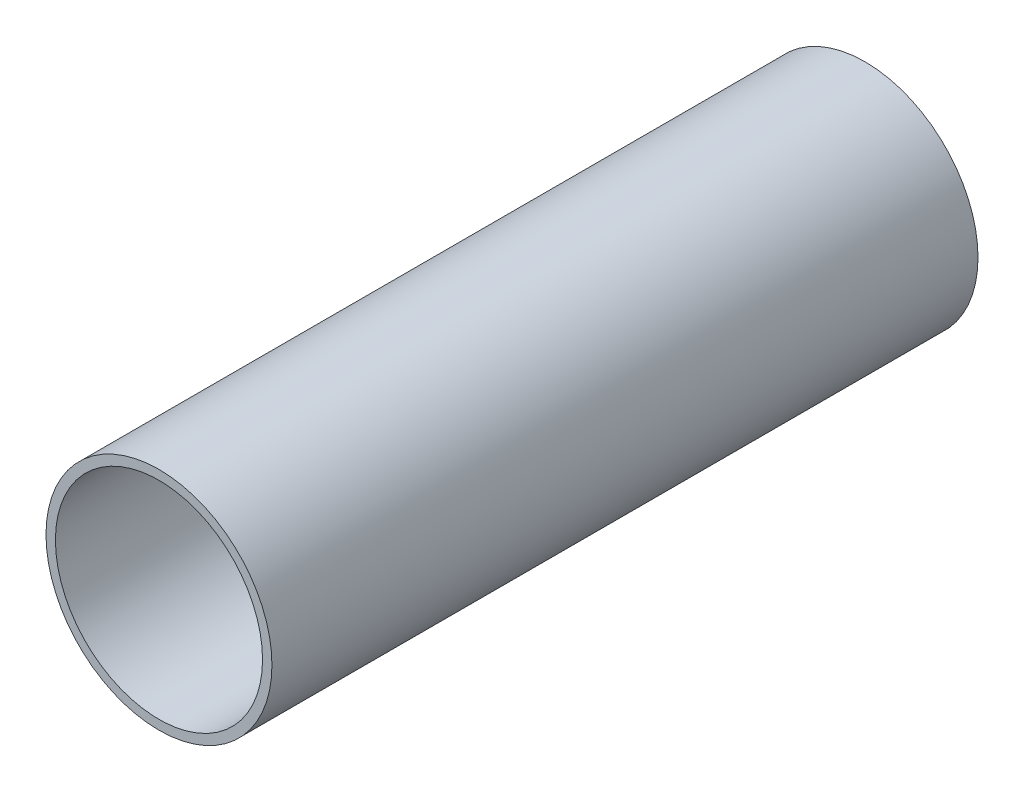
SolidWorks part; units mm, degrees
ref_plane "Face" through (0, 0, 0) normal (0, 0, 1) x (1, 0, 0)
ref_plane "Dessus" through (0, 0, 0) normal (0, 1, 0) x (1, 0, 0)
ref_plane "Droite" through (0, 0, 0) normal (1, 0, 0) x (0, 0, -1)
sketch "Esquisse1" plane through (0, 0, 0) normal (0, 0, 1) x (1, 0, 0)
  circle A0 centre (0, 0) radius 22
  circle A1 centre (0, 0) radius 24
  dimension "D1" = 44
  dimension "D2" = 48
extrude "Extrusion1" add sketch "Esquisse1" along normal blind 150
